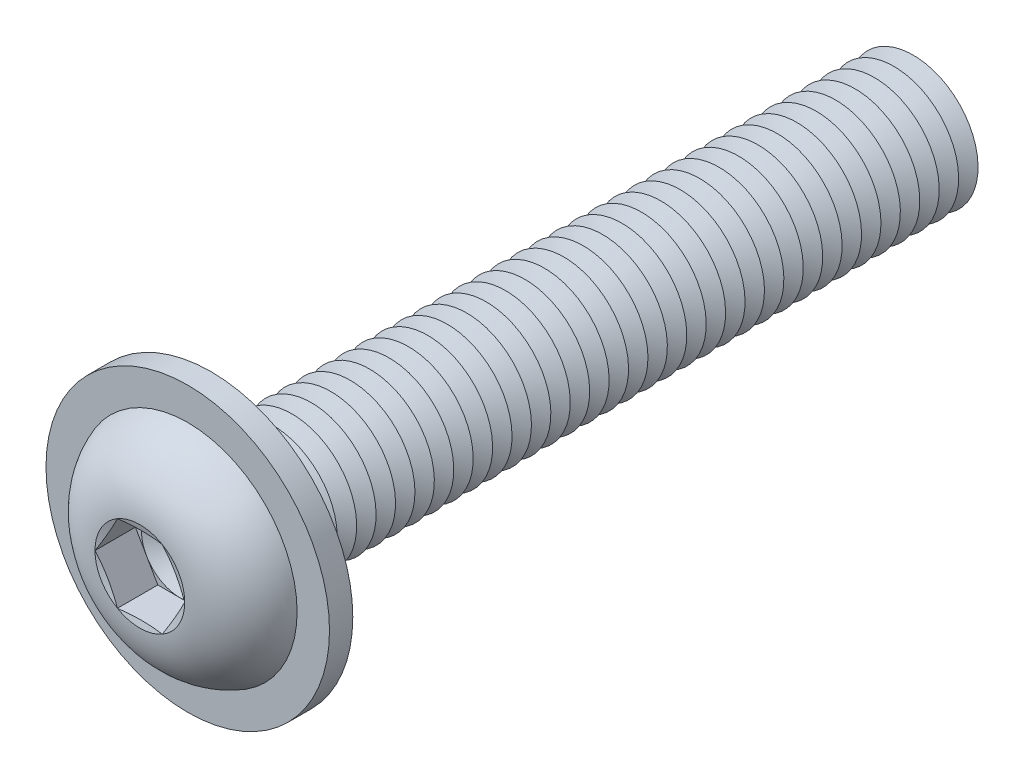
SolidWorks part; units mm, degrees
ref_plane "Front Plane" through (0, 0, 0) normal (0, 0, 1) x (1, 0, 0)
ref_plane "Top Plane" through (0, 0, 0) normal (0, 1, 0) x (1, 0, 0)
ref_plane "Right Plane" through (0, 0, 0) normal (1, 0, 0) x (0, 0, -1)
sketch "Sketch1" plane through (0, 0, 0) normal (1, 0, 0) x (0, 0, -1)
  line L0 (0, 5) -> (0, 8.75)
  line L3 (0, 5) -> (55, 5)
  line L4 (55, 5) -> (55, 0)
  line L5 (55, 0) -> (-5.5, 0) construction
  line L6 (-5.5, 0) -> (55, 0)
  line L7 (-5.5, 3.4641) -> (-5.5, 1.732) construction
  line L8 (-5.5, 1.732) -> (-5.5, 0)
  line L9 (-5.5, 3.4641) -> (-5.0359, 1.732)
  line L10 (-5.0359, 1.732) -> (-5.5, 1.732)
  line L11 (55, 0) -> (22.7481, 0) construction
  line L12 (0, 8.75) -> (-5.5, 8.75) construction
  arc A1 (0, 8.75) -> (-5.5, 3.4641) centre (0, 3.2457) ccw
  point P8 (55, 2.5)
  dimension "D1" = 17.5
  dimension "D2" = 10
  dimension "D3" = 5.5
  dimension "D4" = 6.9282
  dimension "D5" = 55
  dimension "D6" = 15
revolve "Revolve1" add sketch "Sketch1" angle 360 about L5
fillet "Fillet1" radius 0.75 1 edges at (0, 5, 0)
sketch "Sketch2" plane through (0, 0, 0) normal (1, 0, 0) x (0, 0, -1)
  line L0 (54.25, 5) -> (55.75, 5)
  line L1 (55, 5) -> (0.75, 5) construction
  line L2 (55.75, 5) -> (55, 3.701)
  line L3 (55, -5) -> (55, 5) construction
  line L4 (55, 3.701) -> (54.25, 5)
  dimension "D1" = 1.5
revolve "Cut-Revolve1" cut sketch "Sketch2" angle 360 about axis through (0, 0, -55) along (0, 0, -1)
pattern_linear "LPattern1" count 36 spacing 1.5 along (0, 0, 1) of "Cut-Revolve1"
sketch "Sketch3" plane through (0, 0, 5.5) normal (0, 0, 1) x (1, 0, 0)
  line L7 (1.732, 3) -> (-1.7321, 3)
  line L8 (-1.7321, 3) -> (-3.4641, 0)
  line L9 (-3.4641, 0) -> (-1.732, -3)
  line L10 (-1.732, -3) -> (1.732, -3)
  line L11 (1.732, -3) -> (3.4641, 0)
  line L12 (3.4641, 0) -> (1.732, 3)
  circle A0 centre (0, 0) radius 3 construction
  circle A3 centre (0, 0) radius 3.4641 construction
extrude "Cut-Extrude1" cut sketch "Sketch3" against normal blind 3.12
sketch "Sketch4" plane through (0, 0, 2.38) normal (0, 0, 1) x (1, 0, 0)
  line L1 (1.732, 3) -> (-1.7321, 3) construction
  circle A0 centre (0, 0) radius 3
extrude "Cut-Extrude2" cut sketch "Sketch4" against normal through all draft 60
sketch "Sketch5" plane through (0, 0, 0) normal (0, 0, -1) x (-1, 0, 0)
  circle A0 centre (0, 0) radius 10.95
  circle A1 centre (0, 0) radius 5.75
  circle A2 centre (0, 0) radius 5.75 construction
  dimension "D1" = 21.9
extrude "Boss-Extrude1" add sketch "Sketch5" against normal blind 1.8
